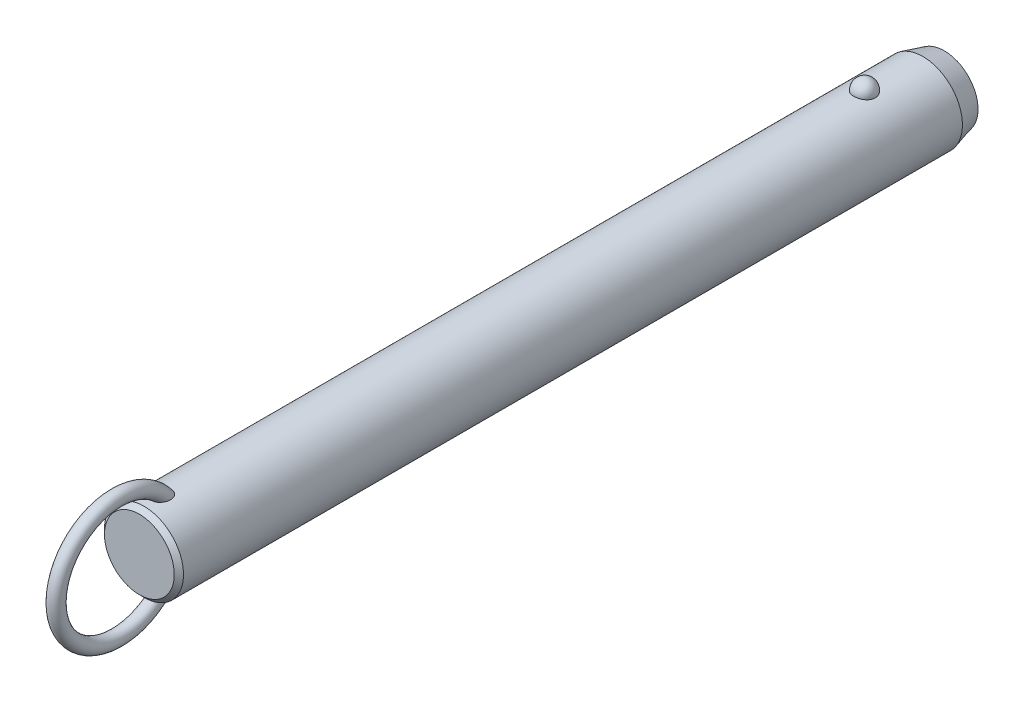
SolidWorks part; units mm, degrees
ref_plane "Front Plane" through (0, 0, 0) normal (0, 0, 1) x (1, 0, 0)
ref_plane "Top Plane" through (0, 0, 0) normal (0, 1, 0) x (1, 0, 0)
ref_plane "Right Plane" through (0, 0, 0) normal (1, 0, 0) x (0, 0, -1)
sketch "Sketch2" plane through (0, 0, 0) normal (0, 0, 1) x (1, 0, 0)
  circle A0 centre (0, 0) radius 11.1
  point P3 (0, 11.1)
  dimension "D1" = 22.2
extrude "Boss-Extrude1" add sketch "Sketch2" along normal blind 188
sketch "Sketch3" plane through (0, 0, 0) normal (0, 0, -1) x (-1, 0, 0)
  circle A0 centre (0, 0) radius 11.1
  dimension "D1" = 22.2
extrude "Boss-Extrude2" add sketch "Sketch3" along normal blind 25.4
chamfer "Chamfer1" distance 6 angle 15 1 edges at (-11.1, 0, -25.4)
sketch "Sketch12" plane through (0, 0, 0) normal (1, 0, 0) x (0, 0, -1)
  line L0 (-188, 11.1) -> (-188, -11.1) construction
  point P0 (-188, 0)
sketch "Sketch13" plane through (0, 0, 0) normal (1, 0, 0) x (0, 0, -1)
  circle A0 centre (-207.05, 0) radius 19.05
  point P2 (-188, 0)
  dimension "D1" = 38.1
sketch "Sketch14" plane through (0, 0, 0) normal (0, 1, 0) x (1, 0, 0)
  circle A0 centre (0, -190) radius 2
  point P2 (0, -188)
  dimension "D1" = 4
sweep "Sweep1" add profiles "Sketch14" path "Sketch13"
sketch "Sketch15" plane through (0, 0, 188) normal (0, 0, 1) x (1, 0, 0)
  circle A0 centre (0, 0) radius 11.1
  dimension "D1" = 22.2
extrude "Boss-Extrude3" add sketch "Sketch15" along normal blind 12.7
chamfer "Chamfer2" distance 1.3 angle 45 1 edges at (11.1, 0, 200.7)
sketch "Sketch18" plane through (0, 0, 0) normal (1, 0, 0) x (0, 0, -1)
  line L0 (19.4, 11.1) -> (-191.568, 11.1) construction
  line L1 (3, 14.1) -> (3, 8.1)
  line L2 (-191.568, -11.1) -> (19.4, -11.1) construction
  arc A0 (3, 14.1) -> (3, 8.1) centre (3, 11.1) ccw
  point P4 (0, 11.1)
  dimension "D1" = 25.2
revolve "Revolve1" add sketch "Sketch18" angle 360 about L1
